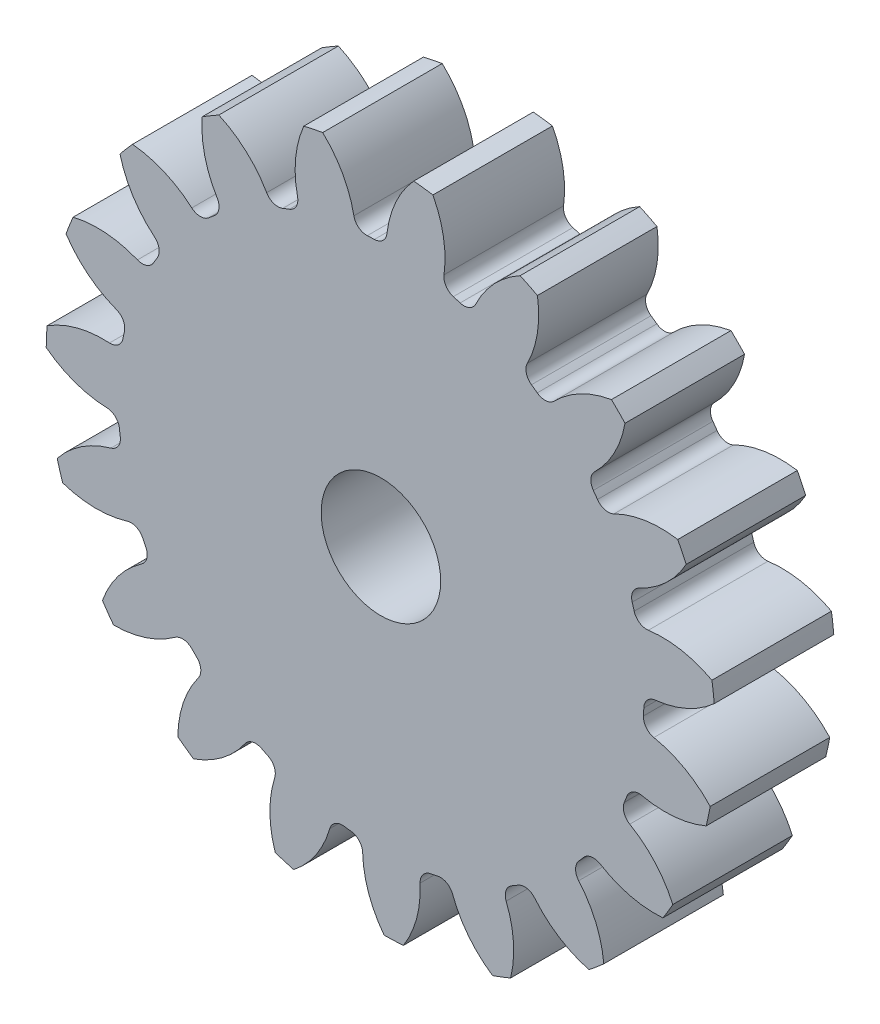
SolidWorks part; units mm, degrees
ref_plane "Front" through (0, 0, 0) normal (0, 0, 1) x (1, 0, 0)
ref_plane "Top" through (0, 0, 0) normal (0, 1, 0) x (1, 0, 0)
ref_plane "Right" through (0, 0, 0) normal (1, 0, 0) x (0, 0, -1)
sketch "Sketch3" plane through (0, 0, 0) normal (0, 0, 1) x (1, 0, 0)
  circle A0 centre (0, 0) radius 355.6
  dimension "od" = 711.2
extrude "gearBody" add sketch "Sketch3" along normal blind 127
sketch "Sketch2" plane through (0, 0, 0) normal (0, 0, 1) x (1, 0, 0)
  line L0 (0, 0) -> (279.3169, 115.6968) construction
  line L1 (351.1798, -65.4776) -> (0, 0) construction
  line L2 (0, 0) -> (36.3143, 0) construction
  line L3 (321.4992, 12.2716) -> (319.1477, -40.7075) construction
  line L5 (320.3234, -14.218) -> (0, 0) construction
  line L7 (0, 0) -> (302.3304, 0) construction
  arc A0 (302.2631, 6.3826) -> (300.5089, -33.1374) centre (0, 0) ccw construction
  arc A1 (354.0913, 32.7215) -> (349.7998, -63.9646) centre (0, 0) ccw construction
  arc A2 (321.4992, 12.2716) -> (319.1477, -40.7075) centre (0, 0) ccw construction
  arc A3 (278.9317, -16.1706) -> (279.2674, -8.6057) centre (0, 0) ccw
  arc A4 (351.1798, -65.4776) -> (289.9764, -30.4819) centre (267.968, -139.9888) ccw
  arc A5 (351.1798, -65.4776) -> (355.6, 34.1063) centre (0, 0) ccw
  arc A6 (355.6, 34.1063) -> (291.5367, 4.6707) centre (279.3169, 115.6968) cw
  arc A7 (279.2674, -8.6057) -> (291.5367, 4.6707) centre (293.0446, -9.0303) cw
  arc A8 (289.9764, -30.4819) -> (278.9317, -16.1706) centre (292.6923, -16.9684) cw
  point P6 (355.6, 34.1063)
  point P22 (351.1798, -65.4776)
  dimension "baseDia" = 604.6609
  dimension "od" = 711.2
  dimension "pd" = 643.4667
  dimension "rd" = 558.8
  dimension "rFillet" = 13.7837
  dimension "pointX" = 355.6
  dimension "pointY" = 34.1063
  dimension "CTT" = 52.9791
  dimension "flankCenterAngle" = 22.5
extrude "toothCut" cut sketch "Sketch2" along normal through all
pattern_circular "CirPattern1" count 19 over 360 about axis through (0, 0, 0) along (0, 0, 1) of "toothCut"
sketch "hub1Dia" plane through (0, 0, 0) normal (0, 0, -1) x (-1, 0, 0)
  circle A0 centre (0, 0) radius 12.7
  dimension "hub1Dia" = 25.4
sketch "hub2Dia" plane through (0, 0, 127) normal (0, 0, 1) x (1, 0, 0)
  circle A0 centre (0, 0) radius 12.7
  dimension "hub2dia" = 25.4
sketch "boreDia" plane through (0, 0, 0) normal (0, 0, 1) x (1, 0, 0)
  circle A0 centre (0, 0) radius 63.5
  dimension "boreDia" = 127
extrude "bore" cut sketch "boreDia" against normal mid plane 25400
